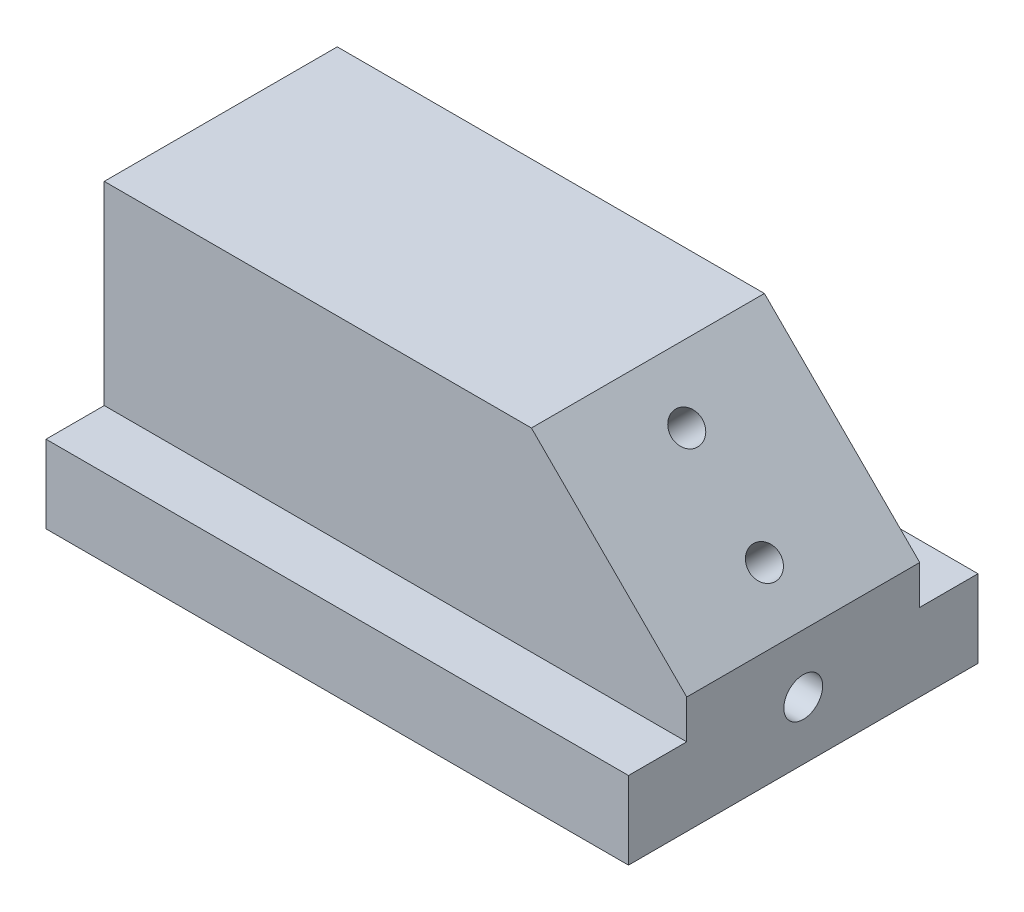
SolidWorks part; units mm, degrees
ref_plane "Front Plane" through (0, 0, 0) normal (0, 0, 1) x (1, 0, 0)
ref_plane "Top Plane" through (0, 0, 0) normal (0, 1, 0) x (1, 0, 0)
ref_plane "Right Plane" through (0, 0, 0) normal (1, 0, 0) x (0, 0, -1)
sketch "Sketch1" plane through (0, 0, 0) normal (0, 0, 1) x (1, 0, 0)
  line L0 (0, 0) -> (40, -40)
  line L1 (40, -40) -> (40, -70)
  line L2 (40, -70) -> (-110, -70)
  line L3 (-110, -70) -> (-110, 0)
  line L4 (-110, 0) -> (0, 0)
  dimension "D1" = 135
  dimension "D2" = 30
  dimension "D3" = 70
  dimension "D4" = 150
extrude "Boss-Extrude1" add sketch "Sketch1" along normal blind 60
hole_wizard "Ø8.0 (8) Diameter Hole2" positions "Sketch5" profile "Sketch6" hole size "Ø8.0" standard "ISO"
sketch "Sketch5" plane through (0, 0, 0) normal (0.7071, 0.7071, 0) x (0.7071, -0.7071, 0)
  line L1 (56.5685, -60) -> (56.5685, 0) construction
  line L2 (0, -60) -> (0, 0) construction
  line L3 (0, -30) -> (28.2843, -30) construction
  line L4 (28.2843, -30) -> (56.5685, -30) construction
  point P0 (14.1421, -30)
  point P2 (42.4264, -30)
  point P18 (42.4264, -30)
  point P20 (14.1421, -30)
sketch "Sketch6" plane through (10, -10, 30) normal (0, 0, 1) x (-0.7071, 0.7071, 0)
  line L0 (0, 0) -> (0, 17.4034)
  line L1 (0, 17.4034) -> (4, 15)
  line L2 (4, 15) -> (4, 0)
  line L5 (4, 0) -> (0, 0)
  line L10 (0, 17.4034) -> (-4, 15) construction
  line L11 (0, -6.35) -> (0, 107.95) construction
  dimension "Hole Dia." = 8
  dimension "Hole Depth" = 15
  dimension "Drill Angle" = 118
sketch "Sketch7" plane through (40, 0, 0) normal (1, 0, 0) x (0, 0, -1)
  line L1 (0, -70) -> (15, -70)
  line L2 (0, -70) -> (0, -50)
  line L3 (0, -50) -> (15, -50)
  line L4 (15, -70) -> (15, -50)
  line L5 (-60, -70) -> (-75, -70)
  line L6 (-60, -70) -> (-60, -50)
  line L7 (-60, -50) -> (-75, -50)
  line L8 (-75, -70) -> (-75, -50)
  dimension "D1" = 20
  dimension "D2" = 20
  dimension "D3" = 15
  dimension "D4" = 15
extrude "Boss-Extrude2" add sketch "Sketch7" against normal up to surface (150 mm away)
sketch "Sketch8" plane through (40, 0, 0) normal (1, 0, 0) x (0, 0, -1)
  line L0 (-75, -70) -> (15, -70) construction
  circle A0 centre (-30, -55) radius 5
  point P4 (-30, -70)
  dimension "D1" = 10
  dimension "D2" = 15
extrude "Cut-Extrude1" cut sketch "Sketch8" against normal blind 20
